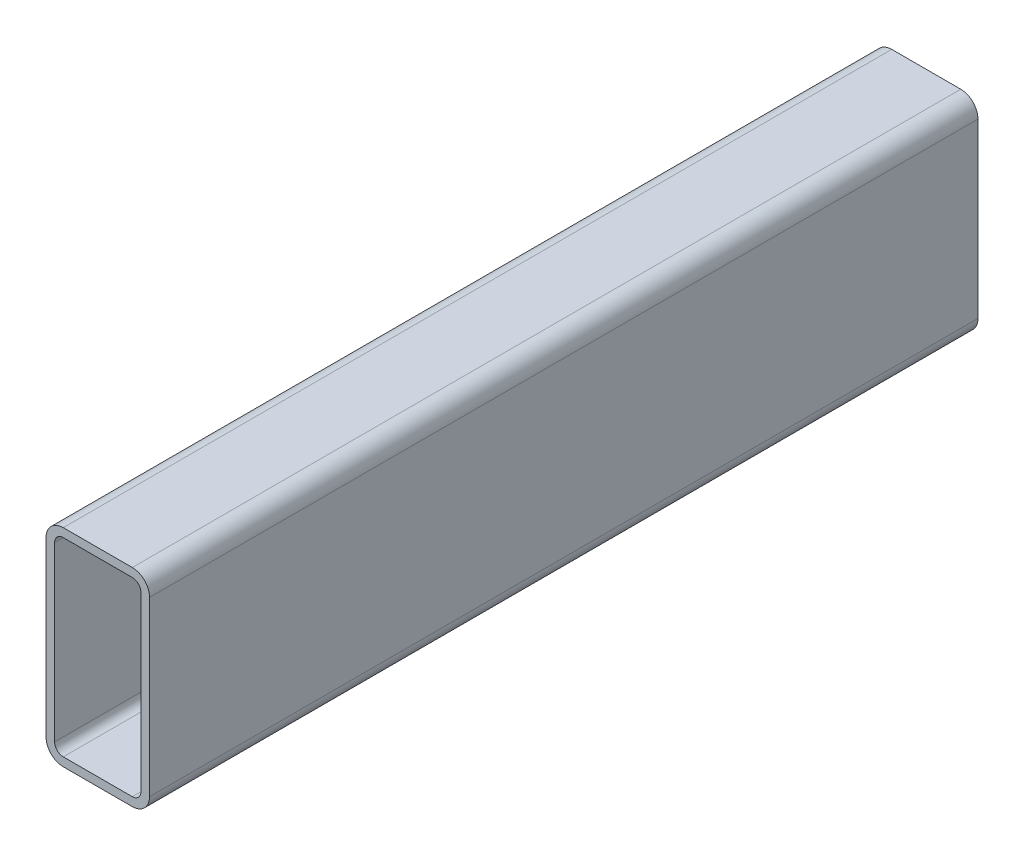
SolidWorks part; units mm, degrees
ref_plane "Front Plane" through (0, 0, 0) normal (0, 0, 1) x (1, 0, 0)
ref_plane "Top Plane" through (0, 0, 0) normal (0, 1, 0) x (1, 0, 0)
ref_plane "Right Plane" through (0, 0, 0) normal (1, 0, 0) x (0, 0, -1)
sketch "Sketch1" plane through (0, 0, 0) normal (0, 0, 1) x (1, 0, 0)
  line B0 (31.75, 76.2) -> (6.35, 76.2)
  arc B1 (38.1, 69.85) -> (31.75, 76.2) centre (31.75, 69.85) ccw
  line B2 (38.1, 6.35) -> (38.1, 69.85)
  arc B3 (31.75, 0) -> (38.1, 6.35) centre (31.75, 6.35) ccw
  line B4 (6.35, 0) -> (31.75, 0)
  arc B5 (0, 6.35) -> (6.35, 0) centre (6.35, 6.35) ccw
  line B6 (0, 69.85) -> (0, 6.35)
  arc B7 (6.35, 76.2) -> (0, 69.85) centre (6.35, 69.85) ccw
  line B8 (6.35, 73.025) -> (31.75, 73.025)
  arc B9 (34.925, 69.85) -> (31.75, 73.025) centre (31.75, 69.85) ccw
  line B10 (34.925, 69.85) -> (34.925, 6.35)
  arc B11 (31.75, 3.175) -> (34.925, 6.35) centre (31.75, 6.35) ccw
  line B12 (31.75, 3.175) -> (6.35, 3.175)
  arc B13 (3.175, 6.35) -> (6.35, 3.175) centre (6.35, 6.35) ccw
  line B14 (3.175, 6.35) -> (3.175, 69.85)
  arc B15 (6.35, 73.025) -> (3.175, 69.85) centre (6.35, 69.85) ccw
sketch_block_instance "HSS3x1.5x0.125-1"
sketch_block "HSS3x1.5x0.125"
extrude "Boss-Extrude1" add sketch "Sketch1" along normal blind 304.8
